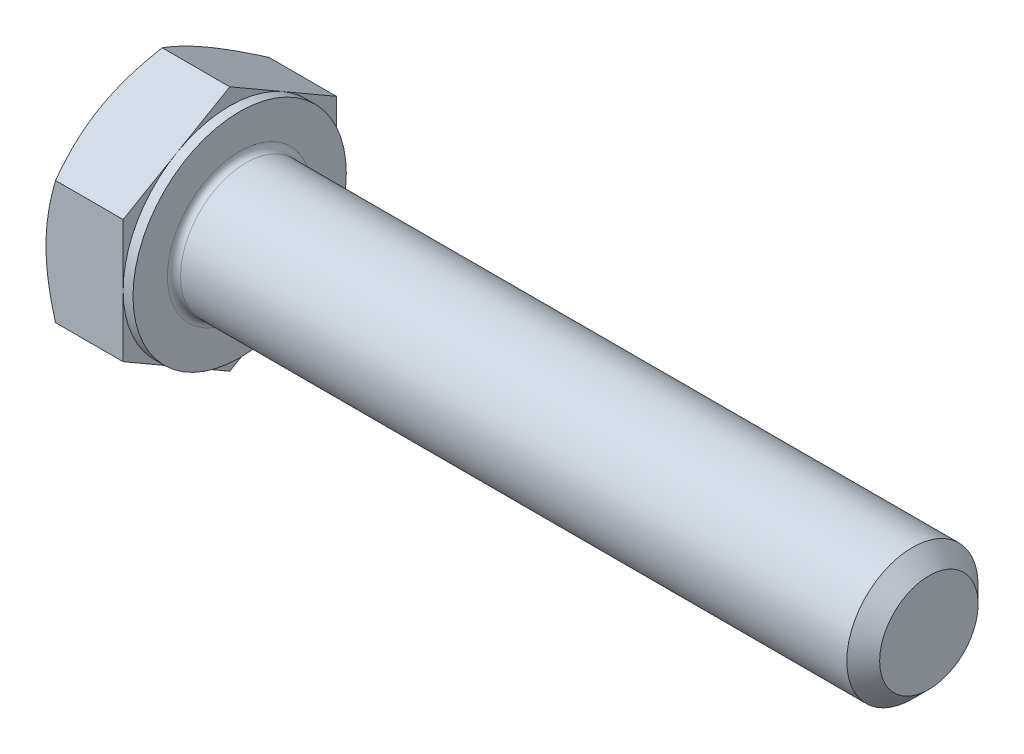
SolidWorks part; units mm, degrees
extrude "基体-拉伸" add sketch "草图1" along normal blind 5.3
sketch "草图1" plane through (0, 0, 0) normal (1, 0, 0) x (0, 0, -1)
  line L0 (6.5, 3.7528) -> (6.5, -3.7528)
  line L1 (-6.5, 3.7528) -> (-6.5, -3.7528)
  line L2 (6.5, -3.7528) -> (0, -7.5056)
  line L3 (0, -7.5056) -> (-6.5, -3.7528)
  line L4 (6.5, 3.7528) -> (0, 7.5056)
  line L5 (0, 7.5056) -> (-6.5, 3.7528)
revolve "切除-旋转1" cut sketch "草图3" angle 360 about L6
sketch "草图3" plane through (0, 0, 0) normal (0, 0, 1) x (1, 0, 0)
  line L0 (0, 6.5) -> (3.4673, 12.5056)
  line L1 (0, 7.5056) -> (0, 3.7528) construction
  line L2 (3.4673, 12.5056) -> (3.4673, 17.5056)
  line L3 (3.4673, 17.5056) -> (-10, 17.5056)
  line L4 (-10, 17.5056) -> (-10, 6.5)
  line L5 (-10, 6.5) -> (0, 6.5)
  line L6 (0, 0) -> (99.06, 0) construction
  line L7 (5.3, 7.5056) -> (0, 7.5056) construction
revolve "凸台-旋转1" add sketch "草图2" angle 360 about L7
sketch "草图2" plane through (0, 0, 0) normal (0, 0, 1) x (1, 0, 0)
  line L0 (0, 3.7528) -> (0, -3.7528) construction
  line L1 (0, 0) -> (47.3, 0)
  line L2 (0, 0) -> (0, 4)
  line L3 (0, 4) -> (47.3, 4)
  line L4 (47.3, 0) -> (47.3, 2.9175)
  line L5 (5.3, 7.5056) -> (5.3, 3.7528) construction
  line L7 (0, 0) -> (96.52, 0) construction
  line L8 (47.3, -2.9175) -> (90.335, -4) construction
  line L9 (0, -4) -> (90.335, -4) construction
  line L10 (6.55, 15.24) -> (6.55, -1.27) construction
  line L11 (5.3, 15.24) -> (5.3, -1.27) construction
  line L12 (5.3, 3.7528) -> (5.3, -3.7528) construction
  line L14 (47.3, 4) -> (47.3, 2.9175)
  dimension "l" = 42
  dimension "m" = 8
  dimension "Minor_dia" = 5.835
  dimension "p" = 1.25
  dimension "h" = 42
ref_plane "前视" through (0, 0, 0) normal (0, 0, 1) x (1, 0, 0)
ref_plane "上视" through (0, 0, 0) normal (0, 1, 0) x (1, 0, 0)
ref_plane "右视" through (0, 0, 0) normal (1, 0, 0) x (0, 0, -1)
sketch "草图5" plane through (0, 0, 0) normal (0, 0, 1) x (1, 0, 0)
  line L0 (5.3, 6.5) -> (1.8327, 12.5056)
  line L1 (5.3, 7.5056) -> (5.3, 3.7528) construction
  line L2 (1.8327, 12.5056) -> (1.8327, 17.5056)
  line L3 (1.8327, 17.5056) -> (11.8327, 17.5056)
  line L4 (11.8327, 17.5056) -> (11.8327, 6.5)
  line L5 (11.8327, 6.5) -> (5.3, 6.5)
  line L7 (5.3, 7.5056) -> (0.5806, 7.5056) construction
  line L8 (0, 0) -> (99.06, 0) construction
  line L9 (0, 0) -> (99.06, 0) construction
revolve "切除-旋转2" cut sketch "草图5" angle 360 about L8
sketch "草图4" plane through (0, 0, 0) normal (0, 0, 1) x (1, 0, 0)
  line L1 (5.3, 7.5056) -> (5.3, 3.7528) construction
  line L2 (5.3, 6.5) -> (4.7, 6.5)
  line L3 (5.3, 6.5) -> (5.3, 17.5056)
  line L4 (5.3, 17.5056) -> (4.7, 17.5056)
  line L5 (0, 0) -> (95.25, 0) construction
  line L6 (0, 0) -> (96.52, 0) construction
  line L7 (4.7, 6.5) -> (4.7, 17.5056)
  line L8 (4.7194, 7.5056) -> (0.5806, 7.5056) construction
revolve "切除-旋转3" cut sketch "草图4" angle 360 about L5
chamfer "倒角" distance 1 angle 45 1 edges at (47.3, 0, 4)
fillet "圆角" radius 0.4 1 edges at (5.3, 0, -4)
sketch "草图6" plane through (0, 0, 0) normal (0, 0, 1) x (1, 0, 0)
  line L0 (6.325, -2.9175) -> (5.7, -4)
  line L1 (6.325, -2.9175) -> (6.95, -4)
  line L2 (6.95, -4) -> (6.95, -5)
  line L3 (-3.175, 0) -> (5.1513, 0) construction
  line L5 (6.95, -5) -> (5.7, -5)
  line L6 (5.7, -5) -> (5.7, -4)
  arc A0 (5.7, -4) -> (5.3, -4.4) centre (5.7, -4.4) ccw construction
revolve "切除-旋转4" [suppressed] cut sketch "草图6" angle 360 about L3
pattern_linear "阵列(线性)1" [suppressed]
equation "\"D3@草图1\" = \"s@草图1\" / 2"
equation "\"D4@草图1\" = \"D3@草图1\""
equation "\"D5@草图1\" = \"D4@草图1\""
equation "\"D1@草图3\" = \"s@草图1\" / 2"
equation "\"D1@草图5\" = \"s@草图1\" / 2"
equation "\"Head_ch_ang@草图5\" = \"Head_ch_ang@草图3\""
equation "\"D1@草图4\" = \"s@草图1\""
equation "\"Diameter@草图6\" = \"m@草图2\""
equation "\"Overcut@草图6\" = \"m@草图2\" * 1.25"
equation "\"Minor_dia@草图2\" = \"m@草图2\"-\"p@草图2\" * 1.732"
equation "\"Thread_minor@螺旋线1\" = \"Minor_dia@草图2\""
equation "\"Thread_minor@草图6\" = \"Minor_dia@草图2\""
equation "\"D1@倒角\" = \"p@草图2\"*0.8"
equation "\"Thread_length@螺旋线1\" = \"l@草图2\" - \"p@草图2\""
equation "\"Num_threads@阵列(线性)1\" = \"l@草图2\" / \"p@草图2\""
